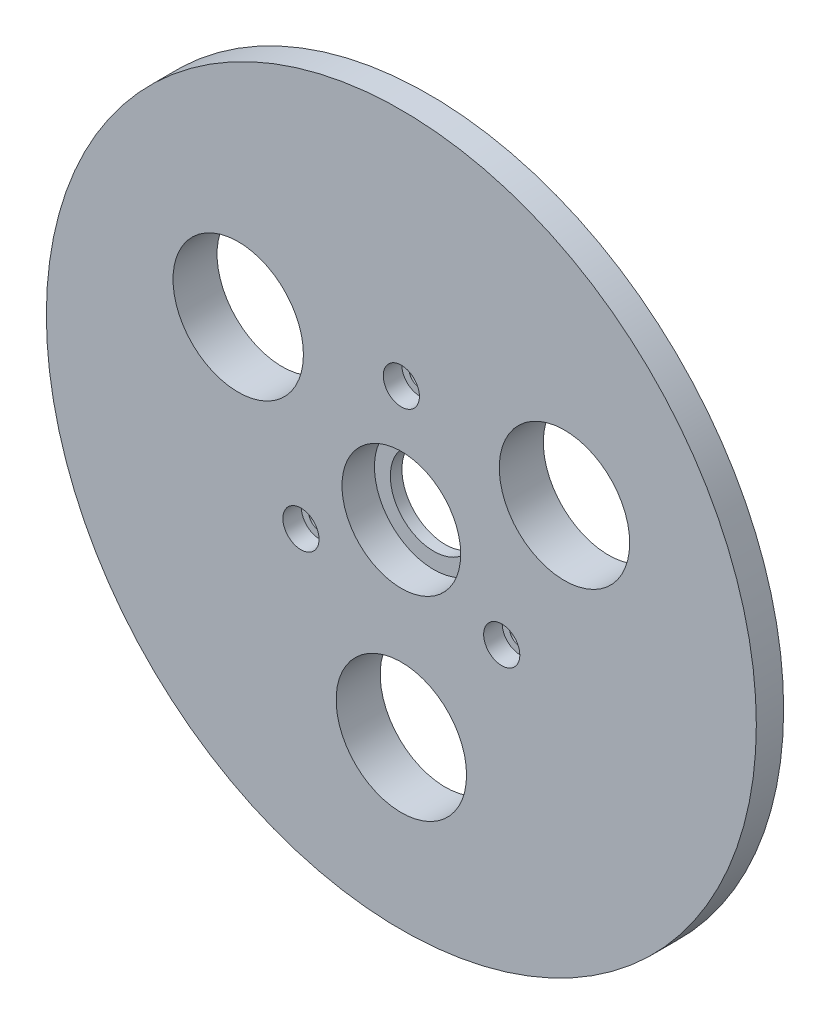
SolidWorks part; units mm, degrees
ref_plane "Front Plane" through (0, 0, 0) normal (0, 0, 1) x (1, 0, 0)
ref_plane "Top Plane" through (0, 0, 0) normal (0, 1, 0) x (1, 0, 0)
ref_plane "Right Plane" through (0, 0, 0) normal (1, 0, 0) x (0, 0, -1)
sketch "Sketch1" plane through (0, 0, 0) normal (0, 0, 1) x (1, 0, 0)
  line L0 (0, 0) -> (0, 25.4)
  line L1 (0, 0) -> (21.997, -12.7)
  line L2 (0, 0) -> (-21.997, -12.7)
  circle A0 centre (0, 0) radius 77.7875
  circle A1 centre (0, 0) radius 9.525
  circle A2 centre (0, 0) radius 13.0048
  circle A3 centre (0, 25.4) radius 2.3876
  circle A4 centre (0, 25.4) radius 3.9624
  circle A5 centre (21.997, -12.7) radius 2.3876
  circle A6 centre (21.997, -12.7) radius 3.9624
  circle A7 centre (-21.997, -12.7) radius 2.3876
  circle A8 centre (-21.997, -12.7) radius 3.9624
  dimension "D1" = 155.575
  dimension "D2" = 19.05
  dimension "D3" = 26.0096
  dimension "D4" = 4.7752
  dimension "D5" = 7.9248
  dimension "D6" = 120
  dimension "D7" = 120
  dimension "D8" = 25.4
sketch "Sketch2" plane through (0, 0, 0) normal (0, 0, 1) x (1, 0, 0)
  circle A0 centre (0, 0) radius 77.7875 construction
  circle A1 centre (0, 0) radius 9.525 construction
  circle A2 centre (-21.997, -12.7) radius 2.3876 construction
  circle A3 centre (21.997, -12.7) radius 2.3876 construction
  circle A4 centre (0, 25.4) radius 2.3876 construction
  circle A5 centre (0, 0) radius 77.7875
  circle A6 centre (0, 0) radius 9.525
  circle A7 centre (-21.997, -12.7) radius 2.3876
  circle A8 centre (21.997, -12.7) radius 2.3876
  circle A9 centre (0, 25.4) radius 2.3876
extrude "Boss-Extrude1" add sketch "Sketch2" along normal blind 9.652
sketch "Sketch3" plane through (0, 0, 9.652) normal (0, 0, 1) x (1, 0, 0)
  circle A0 centre (0, 0) radius 13.0048 construction
  circle A1 centre (0, 0) radius 13.0048
extrude "Cut-Extrude1" cut sketch "Sketch3" against normal blind 7.112
sketch "Sketch4" plane through (0, 0, 9.652) normal (0, 0, 1) x (1, 0, 0)
  circle A0 centre (-21.997, -12.7) radius 3.9624 construction
  circle A1 centre (21.997, -12.7) radius 3.9624 construction
  circle A2 centre (0, 25.4) radius 3.9624 construction
  circle A3 centre (-21.997, -12.7) radius 3.9624
  circle A4 centre (21.997, -12.7) radius 3.9624
  circle A5 centre (0, 25.4) radius 3.9624
extrude "Cut-Extrude2" cut sketch "Sketch4" against normal blind 4.064
chamfer "Chamfer1" distance 6.35 angle 30 1 edges at (77.7875, 0, 0)
sketch "Sketch5" plane through (0, 0, 0) normal (0, 0, 1) x (1, 0, 0)
  line L0 (0, 0) -> (0, -41.275) construction
  line L1 (0, 0) -> (-35.7452, 20.6375) construction
  line L2 (0, 0) -> (35.7452, 20.6375) construction
  circle A0 centre (0, -41.275) radius 14.2875
  circle A1 centre (35.7452, 20.6375) radius 14.2875
  circle A2 centre (-35.7452, 20.6375) radius 14.2875
  dimension "D3" = 28.575
  dimension "D1" = 120
  dimension "D2" = 120
  dimension "D4" = 41.275
extrude "Cut-Extrude3" cut sketch "Sketch5" along normal blind 25.4
